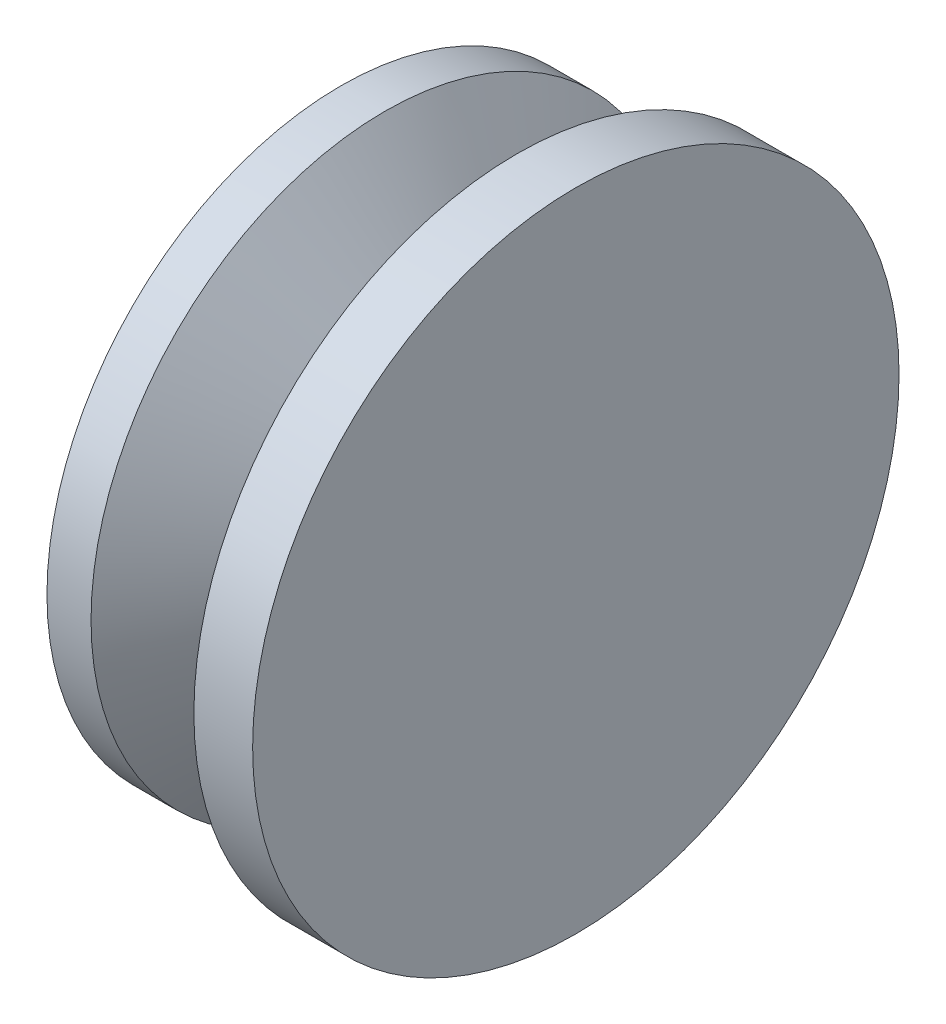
SolidWorks part; units mm, degrees
ref_plane "前视基准面" through (0, 0, 0) normal (0, 0, 1) x (1, 0, 0)
ref_plane "上视基准面" through (0, 0, 0) normal (0, 1, 0) x (1, 0, 0)
ref_plane "右视基准面" through (0, 0, 0) normal (1, 0, 0) x (0, 0, -1)
sketch "草图1" plane through (0, 0, 25) normal (0, 0, 1) x (1, 0, 0)
  line L0 (58, 39) -> (24.6129, 39) construction
  line L1 (58, 28) -> (58, 50) construction
  line L2 (51, 39) -> (51, 49)
  line L3 (51, 49) -> (52.5, 49)
  line L4 (52.5, 49) -> (54.5, 46.0041)
  line L5 (51, 39) -> (59, 39)
  line L6 (54.5, 46.0041) -> (57, 46.0041)
  line L7 (57, 28) -> (57, 50) construction
  line L8 (57, 46.0041) -> (57, 50)
  line L9 (57, 50) -> (59, 50)
  line L10 (59, 50) -> (59, 39)
  dimension "D1" = 7
  dimension "D2" = 10
  dimension "D3" = 1.5
  dimension "D4" = 7.0041
  dimension "D5" = 2
  dimension "D6" = 2
  dimension "D7" = 11
revolve "旋转1" add sketch "草图1" angle 360 about L0
